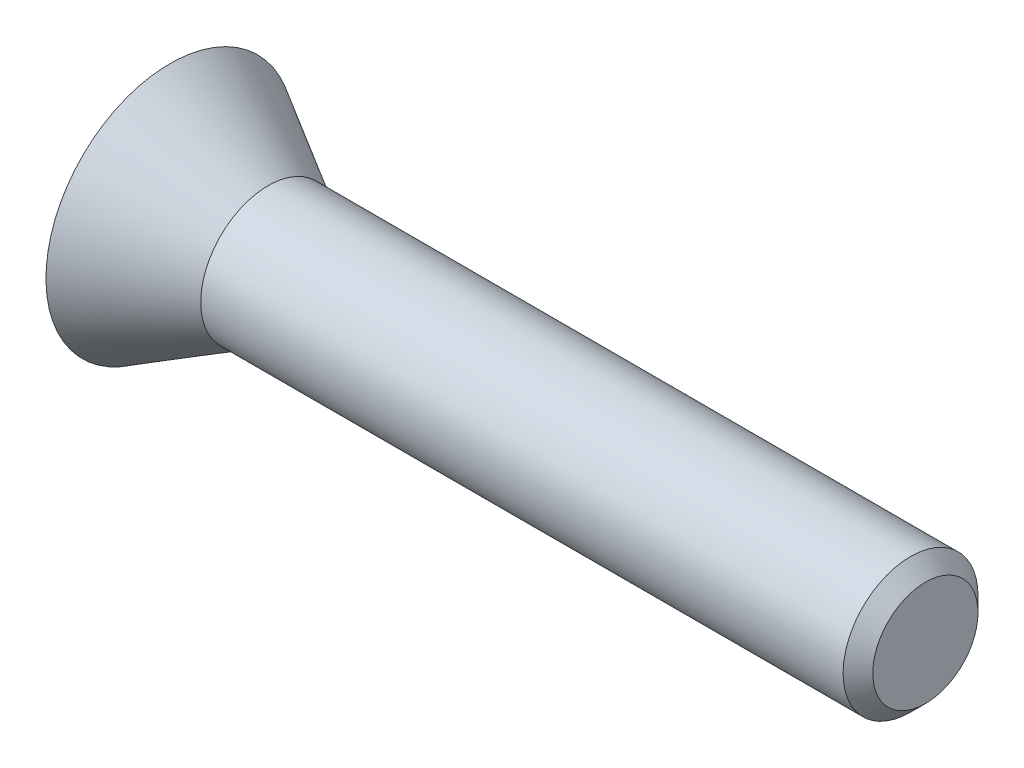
SolidWorks part; units mm, degrees
ref_plane "Front Plane" through (0, 0, 0) normal (0, 0, 1) x (1, 0, 0)
ref_plane "Top Plane" through (0, 0, 0) normal (0, 1, 0) x (1, 0, 0)
ref_plane "Right Plane" through (0, 0, 0) normal (1, 0, 0) x (0, 0, -1)
sketch "Sketch1" plane through (0, 0, 0) normal (1, 0, 0) x (0, 0, -1)
  circle A0 centre (0, 0) radius 2.3
  dimension "D1" = 4.6
extrude "Boss-Extrude1" add sketch "Sketch1" along normal mid plane 14 contours A0
sketch "Sketch2" plane through (0, 0, 0) normal (0, 0, 1) x (1, 0, 0)
  line L0 (-5.1813, 1.25) -> (7, 1.25)
  line L1 (7, -2.3) -> (7, 2.3) construction
  line L2 (7, 1.25) -> (7, 2.3)
  line L3 (-5.1813, 1.25) -> (-7, 2.3)
  line L4 (-7, 2.3) -> (7, 2.3)
  line L5 (-7, 2.3) -> (-7, -2.3) construction
  line L6 (-7, 0) -> (7, 0) construction
  dimension "D1" = 30
  dimension "D2" = 2.5
revolve "Cut-Revolve1" cut sketch "Sketch2" angle 360 about L6
sketch "Sketch3" plane through (-7, 0, 0) normal (-1, 0, 0) x (0, 0, 1)
  line L1 (0.23, 1.01) -> (0.23, -1.52)
  line L2 (0.55, 1.01) -> (0.23, 1.01)
  line L3 (0, 1.93) -> (0.55, 1.01)
  line L4 (0, 1.93) -> (-0.55, 1.01)
  line L5 (-0.55, 1.01) -> (-0.23, 1.01)
  line L6 (-0.23, 1.01) -> (-0.23, -1.52)
  line L7 (0, 2.3) -> (0, -2.3) construction
  arc A0 (-0.23, -1.52) -> (0.23, -1.52) centre (0, -1.52) ccw
  circle A1 centre (0, 0) radius 2.3 construction
  dimension "D6" = 0.46
  dimension "D2" = 0.55
  dimension "D3" = 1.1
  dimension "D1" = 0.37
  dimension "D5" = 0.92
extrude "Cut-Extrude1" cut sketch "Sketch3" against normal blind 0.6
chamfer "Chamfer1" distance 0.275 angle 45 1 edges at (7, -1.25, 0)
sketch "Sketch4" plane through (-7, 0, 0) normal (-1, 0, 0) x (0, 0, 1)
  text T0 "2  6" font "Bahnschrift" height 1.6
  dimension "D1" = 0.9
extrude "Cut-Extrude2" cut sketch "Sketch4" against normal blind 0.6
